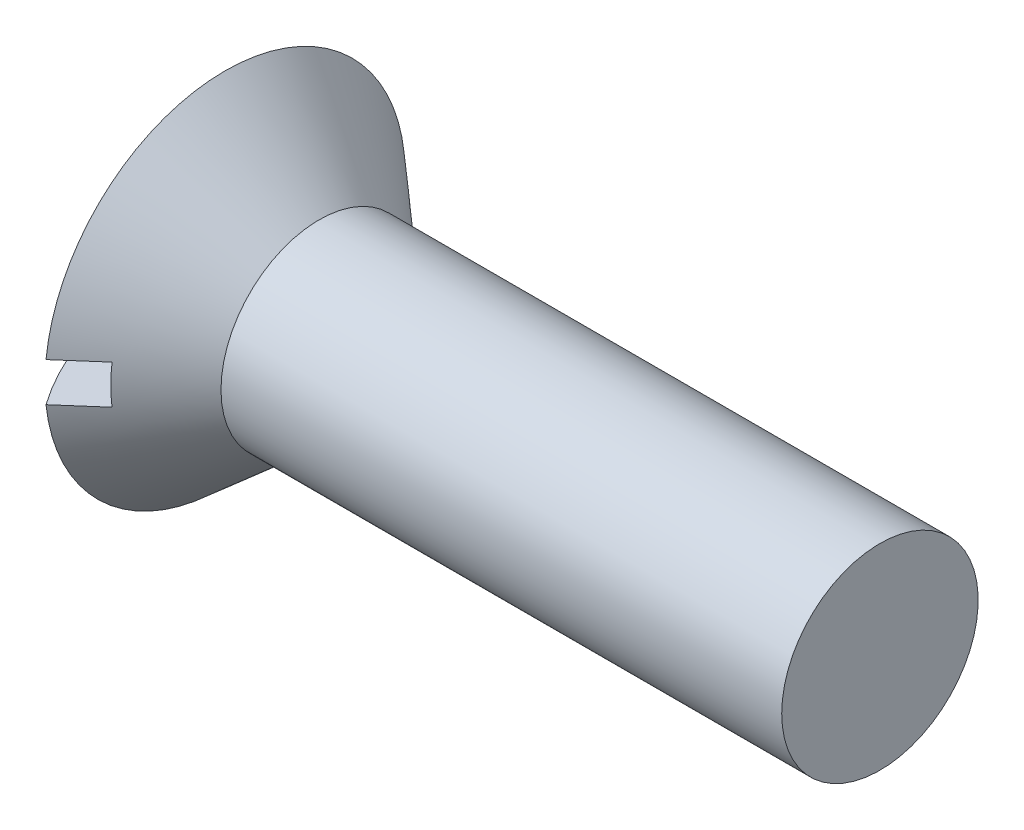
SolidWorks part; units mm, degrees
ref_plane "Plane1" through (0, 0, 0) normal (0, 0, 1) x (1, 0, 0)
ref_plane "Plane2" through (0, 0, 0) normal (0, 1, 0) x (1, 0, 0)
ref_plane "Plane3" through (0, 0, 0) normal (1, 0, 0) x (0, 0, -1)
sketch "BodySke" plane through (0, 0, 0) normal (0, 0, 1) x (1, 0, 0)
  line L0 (0, 0) -> (69.0502, 0)
  line L1 (69.0502, 0) -> (69.0502, 9.525)
  line L2 (69.0502, 9.525) -> (14.6812, 9.525)
  line L3 (5.5502, -17.4625) -> (14.6812, -9.525) construction
  line L4 (-15.875, 0) -> (82.55, 0) construction
  line L5 (5.5502, 17.4625) -> (14.6812, 9.525)
  line L6 (15.4749, 12.7) -> (15.475, -3.175) construction
  line L7 (37.3002, 12.7) -> (37.3002, -3.175) construction
  arc A0 (0, 0) -> (5.5502, 17.4625) centre (30.2463, 0) cw
  dimension "Length" = 63.5
  dimension "Diameter" = 19.05
  dimension "Head_ht" = 14.6812
  dimension "Head_dia" = 34.925
  dimension "Head_ang" = 82
  dimension "Advance" = 1.5875
  dimension "Thread_nom" = 31.75
revolve "Base-Revolve" add sketch "BodySke" angle 360 about L4
sketch "Sketch2" plane through (0, 0, 0) normal (1, 0, 0) x (0, 0, -1)
  line L0 (17.4625, -1.8923) -> (-17.4625, -1.8923)
  line L1 (17.4625, -1.8923) -> (17.4625, 1.8923)
  line L2 (-17.4625, 1.8923) -> (17.4625, 1.8923)
  line L3 (-17.4625, 1.8923) -> (-17.4625, -1.8923)
  dimension "D1" = 34.925
  dimension "Slot_width" = 3.7846
  dimension "D3" = 17.4625
  dimension "D4" = 1.8923
extrude "Slot" cut sketch "Sketch2" along normal blind 8.9662
sketch "Sketch3" plane through (0, 0, 0) normal (1, 0, 0) x (0, 0, -1)
  line L0 (1.3208, -8.3312) -> (-1.3208, -8.3312)
  line L1 (1.3208, -8.3312) -> (1.3208, 8.3312)
  line L2 (-1.3208, 8.3312) -> (1.3208, 8.3312)
  line L3 (-1.3208, 8.3312) -> (-1.3208, -8.3312)
  dimension "D1" = 1.3208
  dimension "Cross_width" = 2.6416
  dimension "D2" = 8.3312
  dimension "Cross_dia" = 16.6624
ref_plane "Plane4" through (10.16, 0, 0) normal (1, 0, 0) x (0, 0, -1)
sketch "Sketch4" plane through (10.16, 0, 0) normal (1, 0, 0) x (0, 0, -1)
  line L0 (0.6604, -0.6604) -> (-0.6604, -0.6604)
  line L1 (0.6604, -0.6604) -> (0.6604, 0.6604)
  line L2 (-0.6604, 0.6604) -> (0.6604, 0.6604)
  line L3 (-0.6604, 0.6604) -> (-0.6604, -0.6604)
  dimension "D1" = 1.3208
  dimension "D2" = 1.3208
  dimension "D3" = 0.6604
  dimension "D4" = 0.6604
loft "Cross" cut profiles "Sketch3", "Sketch4"
pattern_circular "CirPattern1" count 2 every 90 about axis through (0, 0, 0) along (1, 0, 0) of "Cross"
sketch "ThdSchSke" plane through (0, 0, 0) normal (0, 0, 1) x (1, 0, 0)
  line L0 (37.3002, -8.0137) -> (36.242, -9.525)
  line L1 (37.3002, -8.0137) -> (38.3584, -9.525)
  line L2 (38.3584, -9.525) -> (38.3584, -11.9062)
  line L3 (-3.175, 0) -> (5.1513, 0) construction
  line L4 (5.5502, 17.4625) -> (5.5502, 1.8923) construction
  line L5 (38.3584, -11.9062) -> (36.242, -11.9063)
  line L6 (36.242, -11.9063) -> (36.242, -9.525)
  dimension "Thread_minor" = 16.0274
  dimension "Diameter" = 19.05
  dimension "Start" = 31.75
  dimension "SideAngle" = 55
  dimension "VeeAngle" = 70
  dimension "Overcut" = 23.8125
revolve "ThreadSchematic" [suppressed] cut sketch "ThdSchSke" angle 360 about L3
pattern_linear "ThdSchPat" [suppressed]
equation "\"D1@Sketch2\" = \"Head_dia@BodySke\""
equation "\"D3@Sketch2\" = \"D1@Sketch2\" / 2"
equation "\"D4@Sketch2\" = \"Slot_width@Sketch2\" / 2"
equation "\"D1@Sketch3\" = \"Cross_width@Sketch3\" / 2"
equation "\"D2@Sketch3\" = \"Cross_dia@Sketch3\" / 2"
equation "\"D1@Sketch4\" = \"Cross_width@Sketch3\"*.5"
equation "\"D2@Sketch4\" = \"D1@Sketch4\""
equation "\"D3@Sketch4\" = \"D1@Sketch4\" / 2"
equation "\"D4@Sketch4\" = \"D2@Sketch4\" / 2"
equation "\"Thread_length@ThreadCosmetic\" = ((sgn( (\"Length@BodySke\" - \"Advance@BodySke\" - ( ( ( \"Head_dia@BodySke\" - \"Diameter@BodySke\" ) * 0.5 ) / tan( \"Head_ang@BodySke\" * 0.008726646 ) ) ) - \"Thread_nom@Body"
equation "\"Thread_minor@ThdSchSke\" = \"Thread_minor@ThreadCosmetic\""
equation "\"Diameter@ThdSchSke\" = \"Diameter@BodySke\""
equation "\"Overcut@ThdSchSke\" = \"Diameter@BodySke\" * 1.25"
equation "\"Start@ThdSchSke\" = 0.000001 + \"Length@BodySke\" - \"Thread_length@ThreadCosmetic\"  '---Countersunk---"
equation "\"Num_threads@ThdSchPat\" = int( \"Thread_length@ThreadCosmetic\" / \"Advance@BodySke\" + 0.999 )  + 1"
equation "\"Advance@ThdSchPat\" = \"Thread_length@ThreadCosmetic\" /  (\"Num_threads@ThdSchPat\" - 1) 'relax it"
